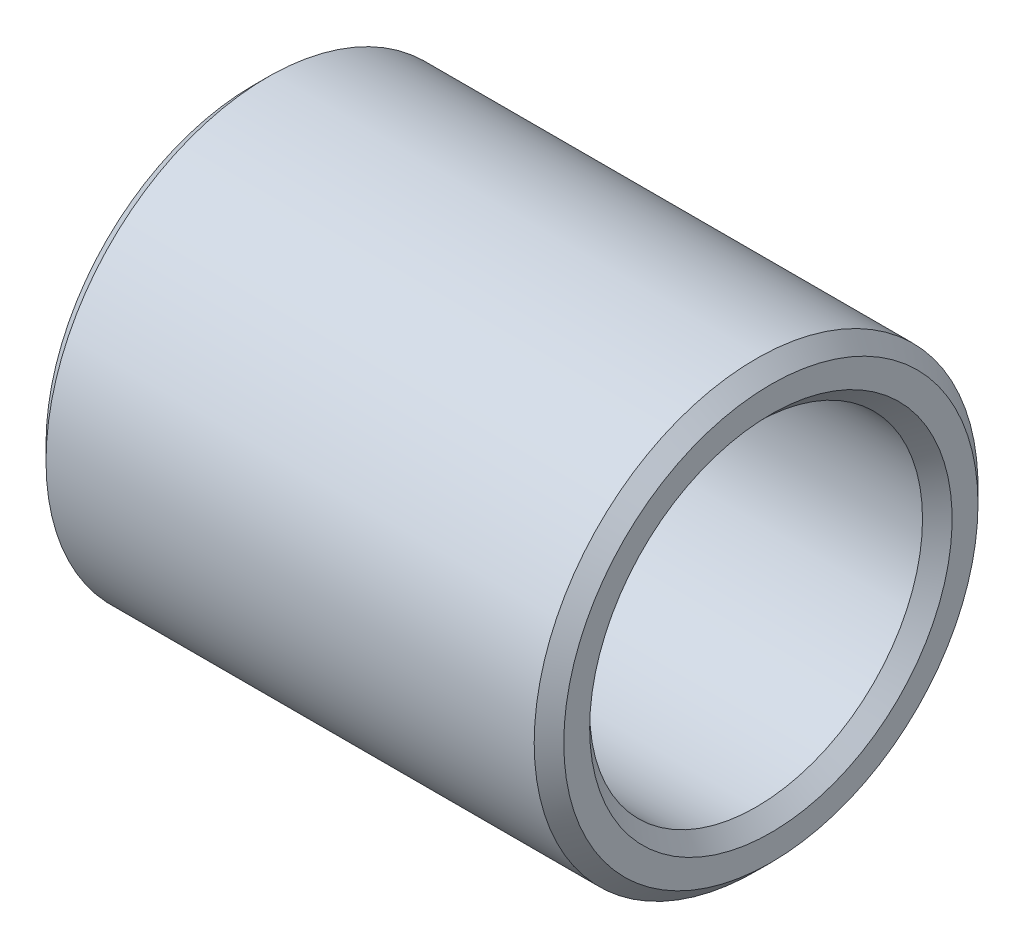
SolidWorks part; units mm, degrees
ref_plane "Plan1" through (0, 0, 0) normal (0, 0, 1) x (1, 0, 0)
ref_plane "Plan2" through (0, 0, 0) normal (0, 1, 0) x (1, 0, 0)
ref_plane "Plan3" through (0, 0, 0) normal (1, 0, 0) x (0, 0, -1)
sketch "Esquisse1" plane through (0, 0, 0) normal (0, 0, 1) x (1, 0, 0)
  line L0 (-7, 4.9) -> (-7, 5.6)
  line L1 (-7, 5.6) -> (-6.6, 6)
  line L2 (-6.6, 6) -> (6.6, 6)
  line L3 (6.6, 6) -> (7, 5.6)
  line L4 (7, 5.6) -> (7, 4.9)
  line L5 (7, 4.9) -> (6.6, 4.5)
  line L6 (6.6, 4.5) -> (-6.6, 4.5)
  line L7 (-6.6, 4.5) -> (-7, 4.9)
  line L8 (0, 0) -> (7, 0) construction
  point P11 (0, 4.5)
  dimension "D1" = 4.5
  dimension "D2" = 6
  dimension "D3" = 14
  dimension "D4" = 45
  dimension "D5" = 45
  dimension "D6" = 45
  dimension "D7" = 45
revolve "Base-Révolution" add sketch "Esquisse1" angle 360 about L8
